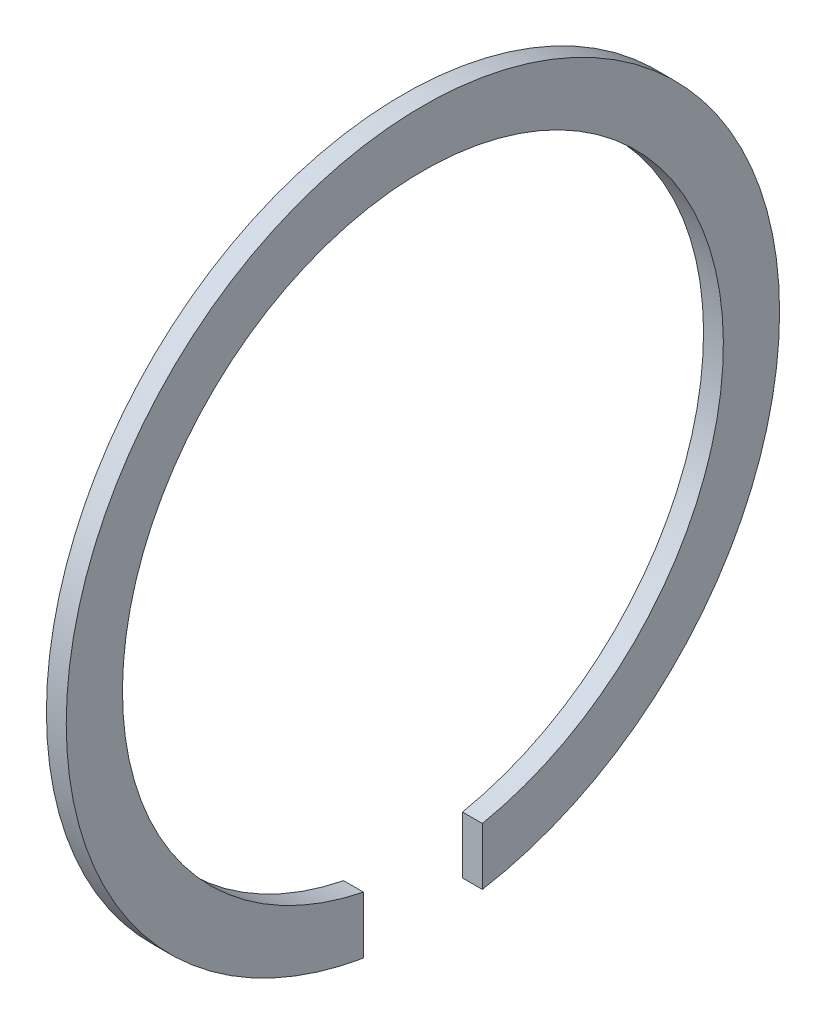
SolidWorks part; units mm, degrees
ref_plane "Face" through (0, 0, 0) normal (0, 0, 1) x (1, 0, 0)
ref_plane "Cote" through (0, 0, 0) normal (0, 1, 0) x (1, 0, 0)
ref_plane "Dessus" through (0, 0, 0) normal (1, 0, 0) x (0, 0, -1)
sketch "Esquisse1" plane through (0, 0, 0) normal (0, 0, 1) x (1, 0, 0)
  line L0 (0, 0) -> (-24.6016, 0) construction
  line L2 (-4, 72) -> (0, 72)
  line L3 (-4, 72) -> (-4, 60.65)
  line L4 (-4, 60.65) -> (0, 60.65)
  line L5 (0, 72) -> (0, 60.65)
  dimension "Ø Intérieur" = 121.3
  dimension "Ø Extérieur" = 144
  dimension "Epaisseur" = 4
revolve "Révolution1" add sketch "Esquisse1" angle 360 about L0
sketch "Esquisse2" plane through (0, 0, 0) normal (1, 0, 0) x (0, 0, -1)
  line L0 (0, 54.3468) -> (0, -54.6382) construction
  line L1 (-55.9495, 0) -> (54.2011, 0) construction
sketch "Esquisse3" plane through (0, 0, 0) normal (1, 0, 0) x (0, 0, -1)
  line L0 (0, 54.3468) -> (0, -54.6382) construction
  line L1 (-12, -0.3104) -> (12, -0.3104)
  line L2 (-12, -0.3104) -> (-12, -413.8808)
  line L3 (-12, -413.8808) -> (12, -413.8808)
  line L4 (12, -0.3104) -> (12, -413.8808)
  dimension "Milieu Encoche" = 12
  dimension "Encoche" = 24
extrude "Enlèv. mat.-Extru.1" cut sketch "Esquisse3" against normal through all
